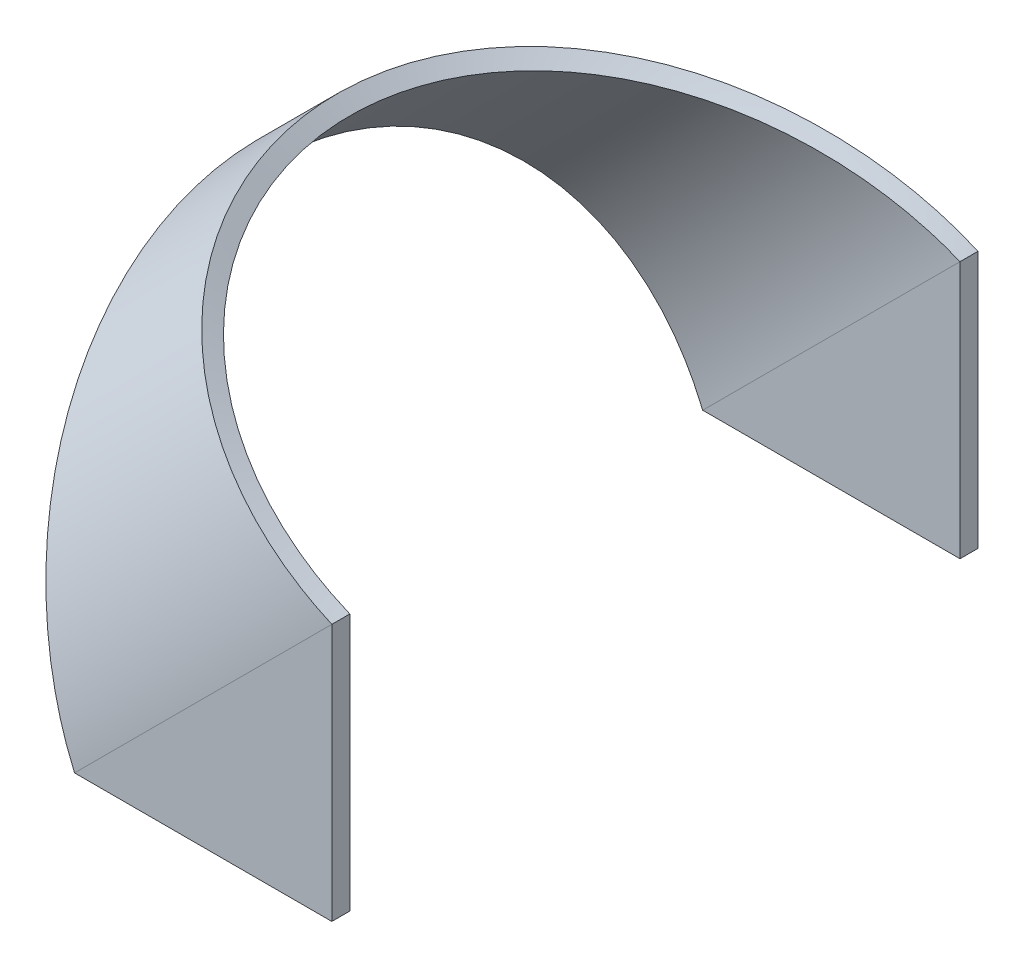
SolidWorks part; units mm, degrees
ref_plane "前视基准面" through (0, 0, 0) normal (0, 0, 1) x (1, 0, 0)
ref_plane "上视基准面" through (0, 0, 0) normal (0, 1, 0) x (1, 0, 0)
ref_plane "右视基准面" through (0, 0, 0) normal (1, 0, 0) x (0, 0, -1)
imported_body "基体零件-带补料的垂直三通管-1"
sheet metal parameters "钣金1" parameters "D1"=0.7366, "厚度"=1
bend "圆角折弯1" bend radius 16.963 bend angle 180 parameters "D5"=1
flatten bends "展开-折弯1" parameters "D1"=0
sketch "尖角-草图1" plane through (0, 0, 16.963) normal (0, 0, -1) x (-1, 0, 0)
  line L0 (33.1473, 18.8412) -> (18.8412, 33.1473) construction
process bends "加工-折弯1" parameters "D1"=0
sketch "平面-草图1" plane through (0, 0, 16.963) normal (0, 0, -1) x (-1, 0, 0)
flat pattern "平板型式1"
sketch "折弯-线1" plane through (0, 0, 0) normal (0, 1, 0) x (-1, 0, 0)
bend of the flat pattern "展开-<圆角折弯1>1"
